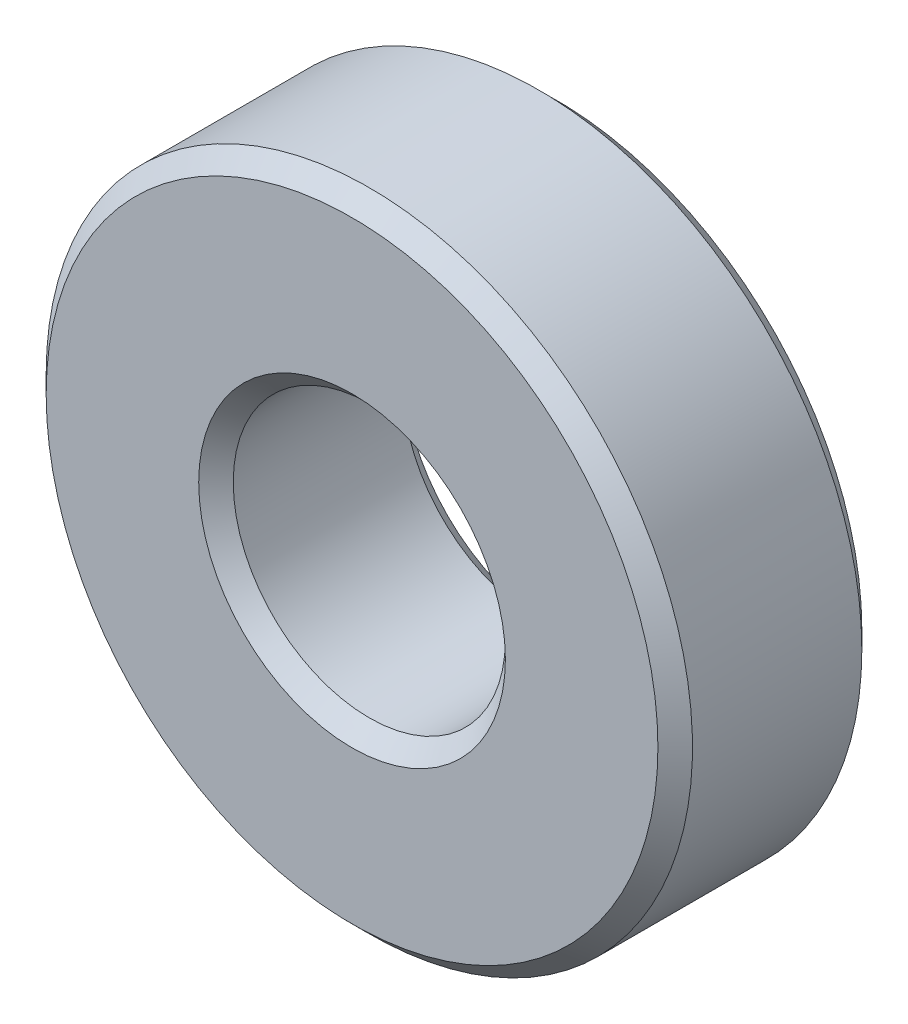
SolidWorks part; units mm, degrees
ref_plane "Front Plane" through (0, 0, 0) normal (0, 0, 1) x (1, 0, 0)
ref_plane "Top Plane" through (0, 0, 0) normal (0, 1, 0) x (1, 0, 0)
ref_plane "Right Plane" through (0, 0, 0) normal (1, 0, 0) x (0, 0, -1)
sketch "Sketch1" plane through (0, 0, 0) normal (0, 0, 1) x (1, 0, 0)
  circle A0 centre (0, 0) radius 4
  circle A1 centre (0, 0) radius 9.5
  dimension "D1" = 19
  dimension "D2" = 8
extrude "Boss-Extrude1" add sketch "Sketch1" along normal blind 5.9944
chamfer "Chamfer1" distance 0.508 angle 45 4 edges at (4, 0, 0) (9.5, 0, 0) (4, 0, 5.9944) (9.5, 0, 5.9944)
